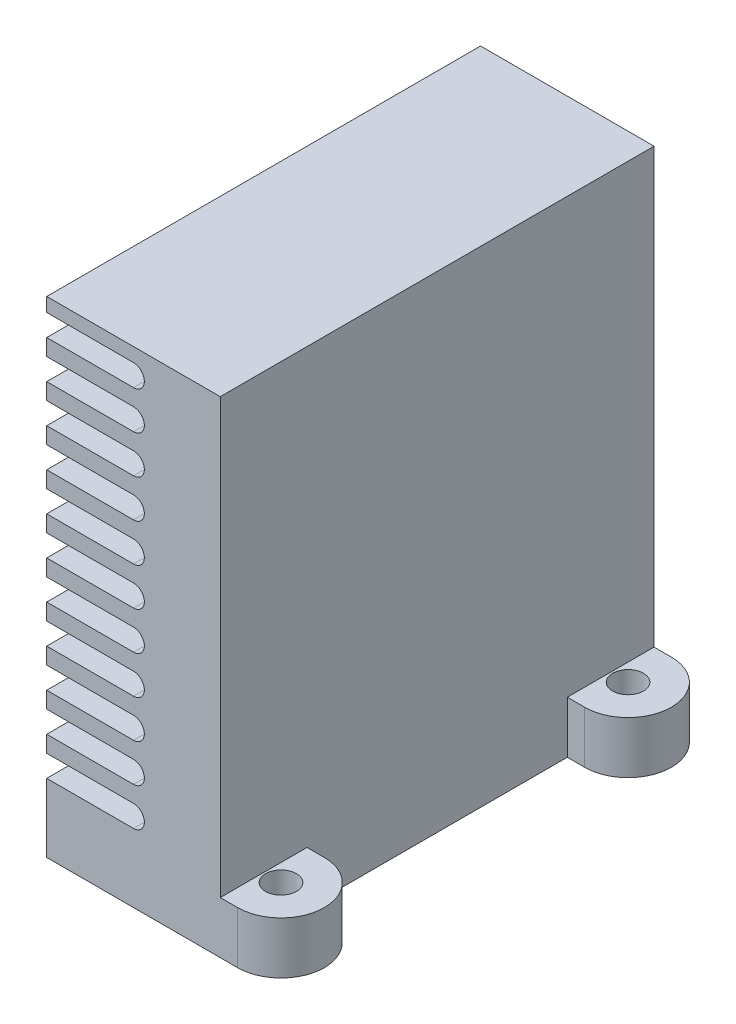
SolidWorks part; units mm, degrees
ref_plane "Front Plane" through (0, 0, 0) normal (0, 0, 1) x (1, 0, 0)
ref_plane "Top Plane" through (0, 0, 0) normal (0, 1, 0) x (1, 0, 0)
ref_plane "Right Plane" through (0, 0, 0) normal (1, 0, 0) x (0, 0, -1)
sketch "Sketch1" plane through (0, 0, 0) normal (0, 0, 1) x (1, 0, 0)
  line L0 (0, 0) -> (0, 35.56)
  line L3 (0, 35.56) -> (-12.7, 35.56)
  line L4 (-12.7, 35.56) -> (-12.7, 0)
  line L7 (-12.7, 0) -> (0, 0)
  dimension "D2" = 35.56
  dimension "D3" = 12.7
extrude "Boss-Extrude1" add sketch "Sketch1" against normal mid plane 31.75
sketch "Sketch2" plane through (0, 0, 15.875) normal (0, 0, 1) x (1, 0, 0)
  line L0 (-12.7, 34.544) -> (-6.35, 34.544)
  line L1 (-12.7, 35.56) -> (-12.7, 0) construction
  line L2 (-12.7, 32.9565) -> (-6.35, 32.9565)
  line L4 (-12.7, 34.544) -> (-12.7, 32.9565)
  line L5 (0, 35.56) -> (-12.7, 35.56) construction
  arc A0 (-6.35, 34.544) -> (-6.35, 32.9565) centre (-6.35, 33.7502) cw
  dimension "D1" = 1.5875
  dimension "D2" = 6.35
  dimension "D3" = 1.016
extrude "Cut-Extrude1" cut sketch "Sketch2" against normal through all
pattern_linear "LPattern1" count 11 spacing 2.794 along (0, -1, 0) of "Cut-Extrude1"
sketch "Sketch6" plane through (0, 0, 0) normal (0, -1, 0) x (1, 0, 0)
  line L0 (0, 15.875) -> (1.27, 15.875)
  line L1 (0, 9.525) -> (1.27, 9.525)
  line L2 (0, -15.875) -> (0, 15.875) construction
  line L3 (0, 15.875) -> (0, 9.525)
  line L4 (0, 0) -> (9.0693, 0) construction
  line L5 (0, -15.875) -> (0, -9.525)
  line L6 (0, -9.525) -> (1.27, -9.525)
  line L7 (0, -15.875) -> (1.27, -15.875)
  arc A0 (1.27, 15.875) -> (1.27, 9.525) centre (1.27, 12.7) cw
  arc A1 (1.27, -15.875) -> (1.27, -9.525) centre (1.27, -12.7) ccw
  dimension "D1" = 6.35
  dimension "D2" = 1.27
extrude "Boss-Extrude2" add sketch "Sketch6" against normal blind 3.81
hole_wizard "#4-40 Tapped Hole1" positions "Sketch4" profile "Sketch3" tap size "#4-40" standard "ANSI Inch"
sketch "Sketch4" plane through (0, 0, 0) normal (0, -1, 0) x (-1, 0, 0)
  arc A0 (-1.27, -9.525) -> (-1.27, -15.875) centre (-1.27, -12.7) ccw construction
  arc A1 (-1.27, 15.875) -> (-1.27, 9.525) centre (-1.27, 12.7) ccw construction
  point P0 (-1.27, 12.7)
  point P2 (-1.27, -12.7)
sketch "Sketch3" plane through (1.27, 0, -12.7) normal (1, 0, 0) x (0, 0, -1)
  line L0 (0, 0) -> (0, 12.1092)
  line L1 (0, 12.1092) -> (1.1303, 11.43)
  line L2 (1.1303, 11.43) -> (1.1303, 0)
  line L5 (1.1303, 0) -> (0, 0)
  line L10 (0, 12.1092) -> (-1.1303, 11.43) construction
  line L11 (0, -6.35) -> (0, 107.95) construction
  dimension "Tap Drill Dia." = 2.2606
  dimension "Tap Drill Depth" = 11.43
  dimension "Drill Angle" = 118
hole_wizard "#8-32 Tapped Hole1" positions "Sketch9" profile "Sketch7" tap size "#8-32" standard "ANSI Inch"
sketch "Sketch9" plane through (0, 0, 0) normal (0, -1, 0) x (-1, 0, 0)
  line L0 (11.5341, 39.8427) -> (11.5341, 14.4427) construction
  line L1 (0, 0) -> (8.892, 0) construction
  line L2 (0, 9.525) -> (0, -9.525) construction
  circle A2 centre (11.5341, 39.8427) radius 1.7272 construction
  point P0 (11.5341, 39.8427)
  point P2 (11.5341, 14.4427)
  dimension "D1" = 25.4
sketch "Sketch7" plane through (-11.5341, 0, -39.8427) normal (1, 0, 0) x (0, 0, -1)
  line L0 (0, 0) -> (0, 35.56)
  line L1 (0, 35.56) -> (1.7272, 35.56)
  line L2 (1.7272, 35.56) -> (1.7272, 0)
  line L5 (1.7272, 0) -> (0, 0)
  line L11 (0, -6.35) -> (0, 107.95) construction
  dimension "Thru Tap Drill Dia." = 3.4544
  dimension "Thru Tap Drill Depth" = 35.56
